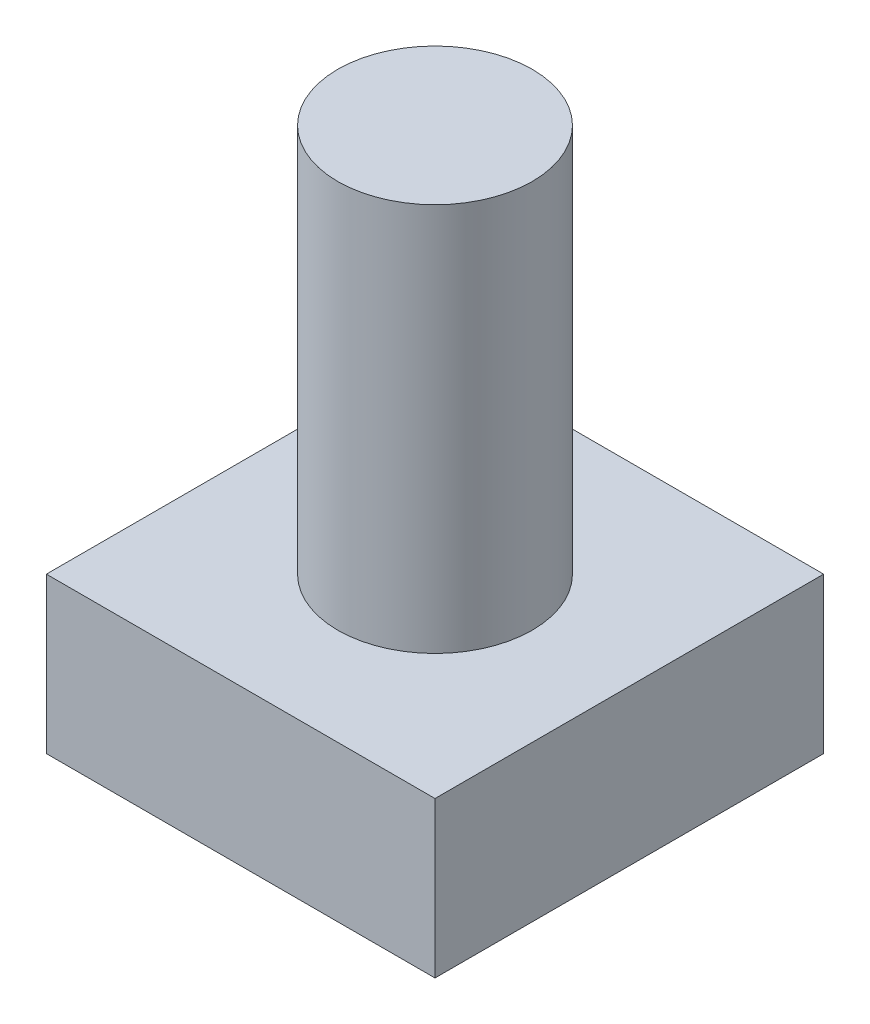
SolidWorks part; units mm, degrees
ref_plane "Plan de face" through (0, 0, 0) normal (0, 0, 1) x (1, 0, 0)
ref_plane "Plan de dessus" through (0, 0, 0) normal (0, 1, 0) x (1, 0, 0)
ref_plane "Plan de droite" through (0, 0, 0) normal (1, 0, 0) x (0, 0, -1)
sketch "Esquisse1" plane through (0, 0, 0) normal (0, 1, 0) x (1, 0, 0)
  line L1 (250, -250) -> (-250, -250)
  line L2 (250, -250) -> (250, 250)
  line L3 (250, 250) -> (-250, 250)
  line L4 (-250, -250) -> (-250, 250)
  line L5 (250, -250) -> (-250, 250) construction
  line L6 (250, 250) -> (-250, -250) construction
  circle A0 centre (0, 0) radius 100
  point P0 (0, 0)
  dimension "D1" = 500
  dimension "1000" = 500
extrude "Boss.-Extru.1" add sketch "Esquisse1" along normal blind 200
sketch "Esquisse2" plane through (0, 200, 0) normal (0, 1, 0) x (1, 0, 0)
  circle A0 centre (0, 0) radius 125.0798
extrude "Boss.-Extru.2" add sketch "Esquisse2" along normal blind 500
